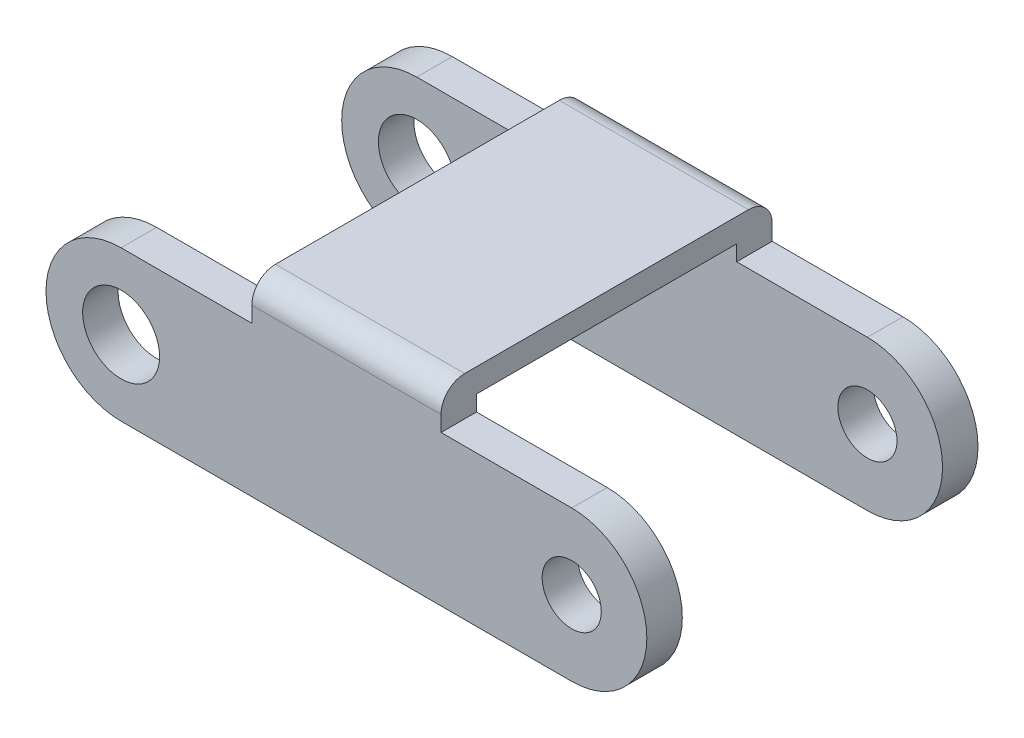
SolidWorks part; units mm, degrees
ref_plane "Front Plane" through (0, 0, 0) normal (0, 0, 1) x (1, 0, 0)
ref_plane "Top Plane" through (0, 0, 0) normal (0, 1, 0) x (1, 0, 0)
ref_plane "Right Plane" through (0, 0, 0) normal (1, 0, 0) x (0, 0, -1)
sketch "Sketch1" plane through (0, 0, 0) normal (0, 0, 1) x (1, 0, 0)
  line L1 (-19.05, 8.5623) -> (19.05, 8.5623)
  line L3 (-19.05, -4.1377) -> (19.05, -4.1377)
  arc A0 (-19.05, 8.5623) -> (-19.05, -4.1377) centre (-19.05, 2.2123) ccw
  arc A1 (19.05, 8.5623) -> (19.05, -4.1377) centre (19.05, 2.2123) cw
  circle A2 centre (-19.05, 2.2123) radius 3.25
  circle A3 centre (19.05, 2.2123) radius 2.5
  point P14 (0, -4.1377)
  dimension "D2" = 6.35
  dimension "D3" = 5
  dimension "D4" = 6.5
  dimension "D1" = 38.1
extrude "Boss-Extrude1" add sketch "Sketch1" against normal blind 3
sketch "Sketch2" plane through (0, 0, 0) normal (1, 0, 0) x (0, 0, -1)
  line L0 (3, 8.5623) -> (3, 9.8823)
  line L1 (3, 9.8823) -> (14, 9.8823)
  line L2 (14, 9.8823) -> (14, 11.8823)
  line L3 (14, 11.8823) -> (2, 11.8823)
  line L4 (0, 9.8823) -> (0, 8.5623)
  line L5 (0, 8.5623) -> (3, 8.5623)
  line L6 (3, -4.1377) -> (3, 8.5623) construction
  arc A0 (0, 9.8823) -> (2, 11.8823) centre (2, 9.8823) cw
  point P12 (3, 2.2123)
  dimension "D1" = 2
  dimension "D2" = 2
  dimension "D3" = 11
  dimension "D4" = 9.67
extrude "Boss-Extrude2" add sketch "Sketch2" along normal mid plane 16
ref_plane "Plane1" through (0, 0, -14) normal (0, 0, -1) x (-1, 0, 0)
mirror "Mirror2" about plane through (0, 0, -14) normal (0, 0, -1) of "Boss-Extrude1", "Boss-Extrude2"
mirror "Mirror3" about plane through (0, 0, -14) normal (0, 0, -1) of "Boss-Extrude1"
